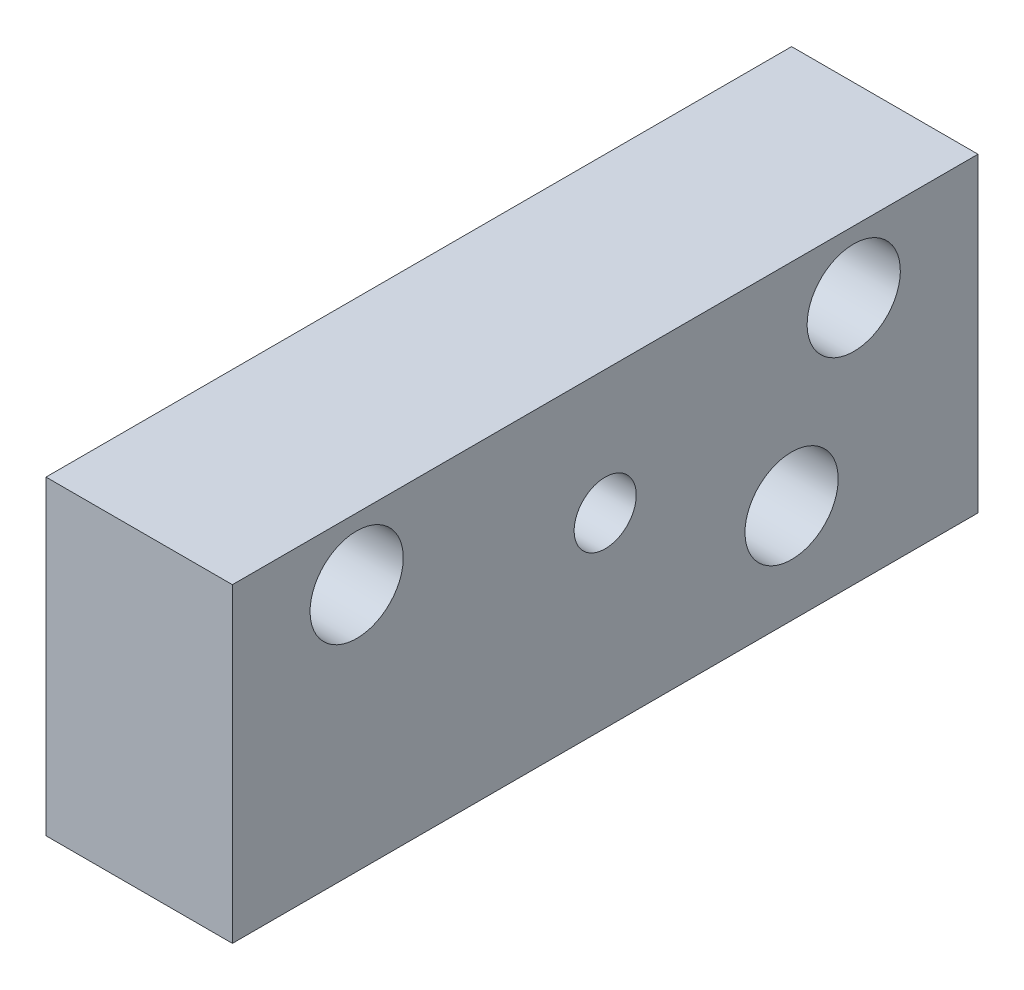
SolidWorks part; units mm, degrees
ref_plane "Front Plane" through (0, 0, 0) normal (0, 0, 1) x (1, 0, 0)
ref_plane "Top Plane" through (0, 0, 0) normal (0, 1, 0) x (1, 0, 0)
ref_plane "Right Plane" through (0, 0, 0) normal (1, 0, 0) x (0, 0, -1)
sketch "Sketch1" plane through (0, 0, 0) normal (0, 0, 1) x (1, 0, 0)
  line L4 (28.575, 3.175) -> (28.575, 31.75)
  line L5 (28.575, 31.75) -> (47.625, 31.75)
  line L6 (47.625, 31.75) -> (47.625, 0)
  line L7 (47.625, 0) -> (28.575, 0)
  line L8 (28.575, 3.175) -> (28.575, 0)
  dimension "D1" = 19.05
extrude "Boss-Extrude1" add sketch "Sketch1" along normal blind 76.2
sketch "Sketch2" plane through (47.625, 0, 0) normal (1, 0, 0) x (0, 0, -1)
  line L0 (0, 0) -> (0, 31.75) construction
  line L1 (-76.2, 0) -> (-76.2, 31.75) construction
  line L2 (-76.2, 31.75) -> (0, 31.75) construction
  circle A0 centre (-38.1, 19.05) radius 3.175
  circle A1 centre (-63.5, 25.4) radius 4.7625
  circle A2 centre (-12.7, 25.4) radius 4.7625
  circle A3 centre (-19.05, 10.16) radius 4.7625
  dimension "D1" = 6.35
  dimension "D2" = 9.525
  dimension "D3" = 38.1
  dimension "D4" = 12.7
  dimension "D5" = 12.7
  dimension "D6" = 6.35
  dimension "D7" = 12.7
  dimension "D8" = 21.59
  dimension "D9" = 19.05
extrude "Cut-Extrude1" cut sketch "Sketch2" against normal up to next
